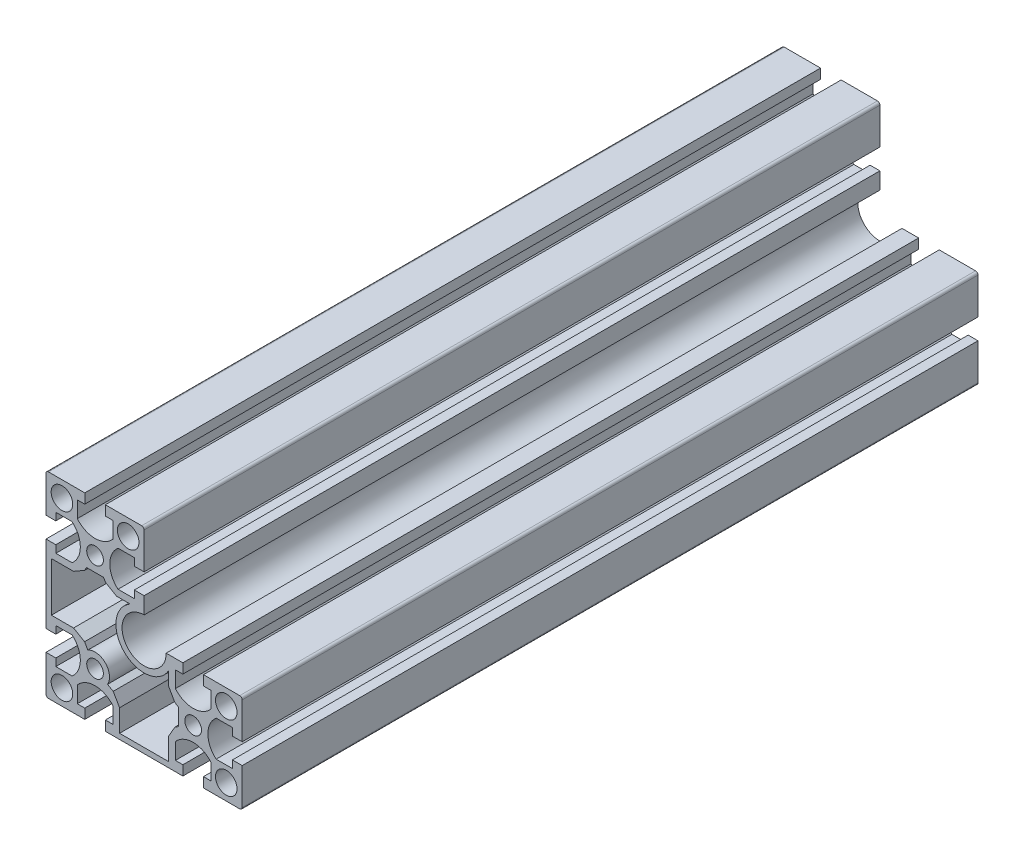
SolidWorks part; units mm, degrees
ref_plane "前视基准面" through (0, 0, 0) normal (0, 0, 1) x (1, 0, 0)
ref_plane "上视基准面" through (0, 0, 0) normal (0, 1, 0) x (1, 0, 0)
ref_plane "右视基准面" through (0, 0, 0) normal (1, 0, 0) x (0, 0, -1)
sketch "Model" plane through (0, 0, 0) normal (0, 0, 1) x (1, 0, 0)
  line L0 (1530.9338, 813.7848) -> (1533.9838, 813.7848)
  line L1 (1533.9838, 813.7848) -> (1533.9838, 817.7848)
  line L2 (1533.9838, 817.7848) -> (1527.1838, 817.7848)
  line L3 (1518.1838, 826.7848) -> (1518.1838, 833.5848)
  line L4 (1518.1838, 833.5848) -> (1514.1838, 833.5848)
  line L5 (1514.1838, 833.5848) -> (1514.1838, 830.5348)
  line L6 (1514.1838, 830.5348) -> (1507.5448, 830.5348)
  line L7 (1507.5448, 845.0348) -> (1514.1838, 845.0348)
  line L8 (1514.1838, 845.0348) -> (1514.1838, 841.9848)
  line L9 (1514.1838, 841.9848) -> (1518.1838, 841.9848)
  line L10 (1518.1838, 841.9848) -> (1518.1838, 856.7848)
  line L11 (1517.1838, 857.7848) -> (1502.3838, 857.7848)
  line L12 (1502.3838, 857.7848) -> (1502.3838, 853.7848)
  line L13 (1502.3838, 853.7848) -> (1505.4338, 853.7848)
  line L14 (1505.4338, 853.7848) -> (1505.4338, 847.1457)
  line L15 (1490.9338, 847.1457) -> (1490.9338, 853.7848)
  line L16 (1490.9338, 853.7848) -> (1493.9838, 853.7848)
  line L17 (1493.9838, 853.7848) -> (1493.9838, 857.7848)
  line L18 (1493.9838, 857.7848) -> (1479.1838, 857.7848)
  line L19 (1478.1838, 856.7848) -> (1478.1838, 841.9848)
  line L20 (1478.1838, 841.9848) -> (1482.1838, 841.9848)
  line L21 (1482.1838, 841.9848) -> (1482.1838, 845.0348)
  line L22 (1482.1838, 845.0348) -> (1488.8228, 845.0348)
  line L23 (1488.8228, 830.5348) -> (1482.1838, 830.5348)
  line L24 (1482.1838, 830.5348) -> (1482.1838, 833.5848)
  line L25 (1482.1838, 833.5848) -> (1478.1838, 833.5848)
  line L26 (1478.1838, 833.5848) -> (1478.1838, 801.9848)
  line L27 (1478.1838, 801.9848) -> (1482.1838, 801.9848)
  line L28 (1482.1838, 801.9848) -> (1482.1838, 805.0348)
  line L29 (1482.1838, 805.0348) -> (1488.8228, 805.0348)
  line L30 (1488.8228, 790.5348) -> (1482.1838, 790.5348)
  line L31 (1482.1838, 790.5348) -> (1482.1838, 793.5848)
  line L32 (1482.1838, 793.5848) -> (1478.1838, 793.5848)
  line L33 (1478.1838, 793.5848) -> (1478.1838, 778.7848)
  line L34 (1479.1838, 777.7848) -> (1493.9838, 777.7848)
  line L35 (1493.9838, 777.7848) -> (1493.9838, 781.7848)
  line L36 (1493.9838, 781.7848) -> (1490.9338, 781.7848)
  line L37 (1490.9338, 781.7848) -> (1490.9338, 788.4238)
  line L38 (1505.4338, 788.4238) -> (1505.4338, 781.7848)
  line L39 (1505.4338, 781.7848) -> (1502.3838, 781.7848)
  line L40 (1502.3838, 781.7848) -> (1502.3838, 777.7848)
  line L41 (1502.3838, 777.7848) -> (1533.9838, 777.7848)
  line L42 (1533.9838, 777.7848) -> (1533.9838, 781.7848)
  line L43 (1533.9838, 781.7848) -> (1530.9338, 781.7848)
  line L44 (1530.9338, 781.7848) -> (1530.9338, 788.4238)
  line L45 (1545.4338, 788.4238) -> (1545.4338, 781.7848)
  line L46 (1545.4338, 781.7848) -> (1542.3838, 781.7848)
  line L47 (1542.3838, 781.7848) -> (1542.3838, 777.7848)
  line L48 (1542.3838, 777.7848) -> (1557.1838, 777.7848)
  line L49 (1558.1838, 778.7848) -> (1558.1838, 793.5848)
  line L50 (1558.1838, 793.5848) -> (1554.1838, 793.5848)
  line L51 (1554.1838, 793.5848) -> (1554.1838, 790.5348)
  line L52 (1554.1838, 790.5348) -> (1547.5448, 790.5348)
  line L53 (1547.5448, 805.0348) -> (1554.1838, 805.0348)
  line L54 (1554.1838, 805.0348) -> (1554.1838, 801.9848)
  line L55 (1554.1838, 801.9848) -> (1558.1838, 801.9848)
  line L56 (1558.1838, 801.9848) -> (1558.1838, 816.7848)
  line L57 (1557.1838, 817.7848) -> (1542.3838, 817.7848)
  line L58 (1542.3838, 817.7848) -> (1542.3838, 813.7848)
  line L59 (1542.3838, 813.7848) -> (1545.4338, 813.7848)
  line L60 (1545.4338, 813.7848) -> (1545.4338, 807.1457)
  line L61 (1530.9338, 807.1457) -> (1530.9338, 813.7848)
  line L62 (1528.1838, 789.0113) -> (1530.7819, 793.5113)
  line L63 (1530.7819, 793.5113) -> (1532.1838, 794.3207)
  line L64 (1532.1838, 794.3207) -> (1532.1838, 801.2489)
  line L65 (1532.1838, 801.2489) -> (1530.7819, 802.0583)
  line L66 (1530.7819, 802.0583) -> (1528.1838, 806.5583)
  line L67 (1528.1838, 806.5583) -> (1528.1838, 812.1058)
  line L68 (1512.5049, 827.7848) -> (1506.9573, 827.7848)
  line L69 (1506.9573, 827.7848) -> (1502.4573, 830.3828)
  line L70 (1502.4573, 830.3828) -> (1501.6479, 831.7848)
  line L71 (1501.6479, 831.7848) -> (1494.7197, 831.7848)
  line L72 (1494.7197, 831.7848) -> (1493.9103, 830.3828)
  line L73 (1493.9103, 830.3828) -> (1489.4103, 827.7848)
  line L74 (1489.4103, 827.7848) -> (1480.3838, 827.7848)
  line L75 (1480.3838, 827.7848) -> (1480.3838, 807.7848)
  line L76 (1480.3838, 807.7848) -> (1489.4103, 807.7848)
  line L77 (1489.4103, 807.7848) -> (1493.9103, 805.1867)
  line L78 (1493.9103, 805.1867) -> (1495.2338, 802.8943)
  line L79 (1503.2933, 794.8348) -> (1505.5857, 793.5113)
  line L80 (1505.5857, 793.5113) -> (1508.1838, 789.0113)
  line L81 (1508.1838, 789.0113) -> (1508.1838, 779.9848)
  line L82 (1508.1838, 779.9848) -> (1528.1838, 779.9848)
  line L83 (1528.1838, 779.9848) -> (1528.1838, 789.0113)
  circle A0 centre (1551.6838, 811.2848) radius 4.4
  circle A2 centre (1551.6838, 784.2848) radius 4.4
  arc A3 (1518.1838, 826.7848) -> (1527.1838, 817.7848) centre (1518.1838, 817.7848) ccw
  arc A4 (1507.5448, 845.0348) -> (1507.5448, 830.5348) centre (1513.6838, 837.7848) ccw
  arc A5 (1518.1838, 856.7848) -> (1517.1838, 857.7848) centre (1517.1838, 856.7848) ccw
  arc A6 (1490.9338, 847.1457) -> (1505.4338, 847.1457) centre (1498.1838, 853.2848) ccw
  arc A7 (1479.1838, 857.7848) -> (1478.1838, 856.7848) centre (1479.1838, 856.7848) ccw
  arc A8 (1488.8228, 830.5348) -> (1488.8228, 845.0348) centre (1482.6838, 837.7848) ccw
  arc A9 (1488.8228, 790.5348) -> (1488.8228, 805.0348) centre (1482.6838, 797.7848) ccw
  arc A10 (1478.1838, 778.7848) -> (1479.1838, 777.7848) centre (1479.1838, 778.7848) ccw
  arc A11 (1505.4338, 788.4238) -> (1490.9338, 788.4238) centre (1498.1838, 782.2848) ccw
  arc A12 (1545.4338, 788.4238) -> (1530.9338, 788.4238) centre (1538.1838, 782.2848) ccw
  arc A13 (1557.1838, 777.7848) -> (1558.1838, 778.7848) centre (1557.1838, 778.7848) ccw
  arc A14 (1547.5448, 805.0348) -> (1547.5448, 790.5348) centre (1553.6838, 797.7848) ccw
  arc A15 (1558.1838, 816.7848) -> (1557.1838, 817.7848) centre (1557.1838, 816.7848) ccw
  arc A16 (1530.9338, 807.1457) -> (1545.4338, 807.1457) centre (1538.1838, 813.2848) ccw
  circle A17 centre (1484.6838, 784.2848) radius 4.4
  arc A18 (1512.5049, 827.7848) -> (1528.1838, 812.1058) centre (1518.1838, 817.7848) ccw
  arc A19 (1503.2933, 794.8348) -> (1495.2338, 802.8943) centre (1498.1838, 797.7848) ccw
  circle A21 centre (1484.6838, 851.2848) radius 4.4
  circle A22 centre (1511.6838, 851.2848) radius 4.4
  circle A23 centre (1538.1838, 797.7848) radius 3.4
  circle A24 centre (1498.1838, 797.7848) radius 3.4
  circle A25 centre (1498.1838, 837.7848) radius 3.4
  dimension "D1" = 8.8
extrude "凸台-拉伸1" add sketch "Model" along normal blind 300
